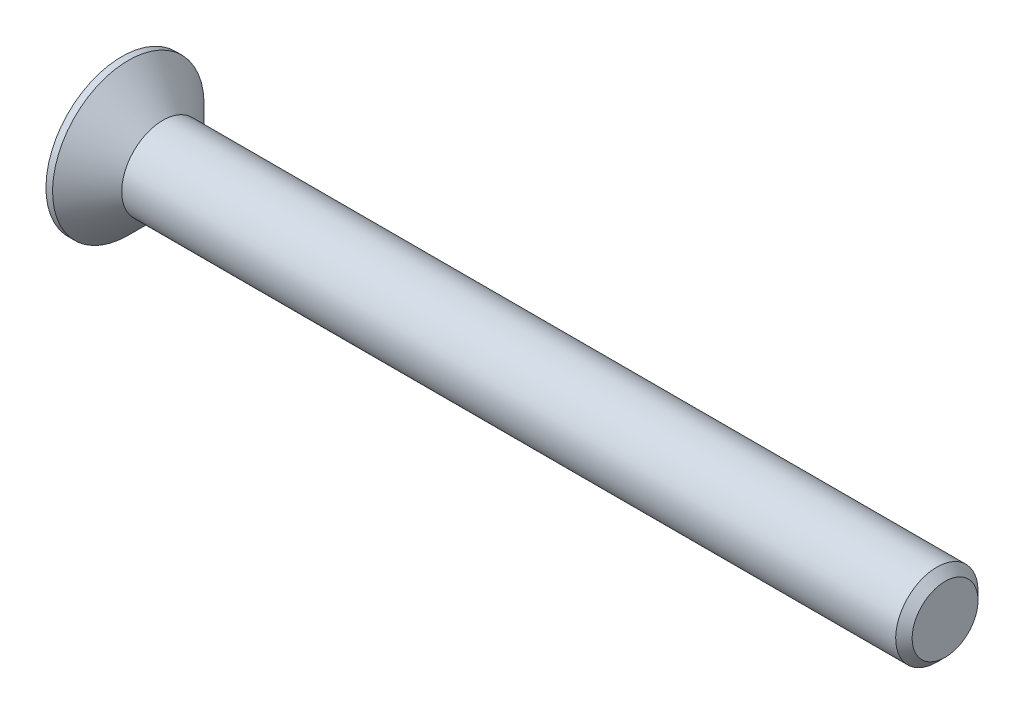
SolidWorks part; units mm, degrees
ref_plane "Front Plane" through (0, 0, 0) normal (0, 0, 1) x (1, 0, 0)
ref_plane "Top Plane" through (0, 0, 0) normal (0, 1, 0) x (1, 0, 0)
ref_plane "Right Plane" through (0, 0, 0) normal (1, 0, 0) x (0, 0, -1)
sketch "Sketch1" plane through (0, 0, 0) normal (0, 0, 1) x (1, 0, 0)
  line L1 (-2.5, 4.6) -> (-2.5, 0)
  line L2 (-2.5, 0) -> (47.5, 0)
  line L3 (47.5, 0) -> (47.5, 2.5)
  line L4 (47.5, 2.5) -> (0, 2.5)
  line L5 (-2.5, 4.6) -> (-2.1, 4.6)
  line L6 (-2.1, 4.6) -> (0, 2.5)
  dimension "D1" = 2.5
  dimension "D2" = 45
  dimension "D3" = 2.5
  dimension "D4" = 50
  dimension "D5" = 4.6
revolve "Revolve1" add sketch "Sketch1" angle 360 about L2
chamfer "Chamfer1" distance 0.5 angle 45 1 edges at (47.5, -2.5, 0)
sketch "Sketch2" plane through (-2.5, 0, 0) normal (-1, 0, 0) x (0, 0, 1)
  line L0 (-0.575, 2.3) -> (0.575, 2.3)
  line L1 (0.575, 2.3) -> (0.575, 0.575)
  line L2 (0.575, 0.575) -> (2.3, 0.575)
  line L3 (2.3, 0.575) -> (2.3, -0.575)
  line L4 (2.3, -0.575) -> (0.575, -0.575)
  line L5 (0.575, -0.575) -> (0.575, -2.3)
  line L6 (0.575, -2.3) -> (-0.575, -2.3)
  line L7 (-0.575, -2.3) -> (-0.575, -0.575)
  line L8 (-0.575, -0.575) -> (-2.3, -0.575)
  line L9 (-2.3, -0.575) -> (-2.3, 0.575)
  line L10 (-2.3, 0.575) -> (-0.575, 0.575)
  line L11 (-0.575, 0.575) -> (-0.575, 2.3)
  point P2 (0, 2.3)
  point P14 (0, -2.3)
  point P15 (2.3, 0)
  point P16 (-2.3, 0)
  dimension "D1" = 4.6
  dimension "D2" = 1.15
extrude "Cut-Extrude1" cut sketch "Sketch2" against normal blind 2.1
